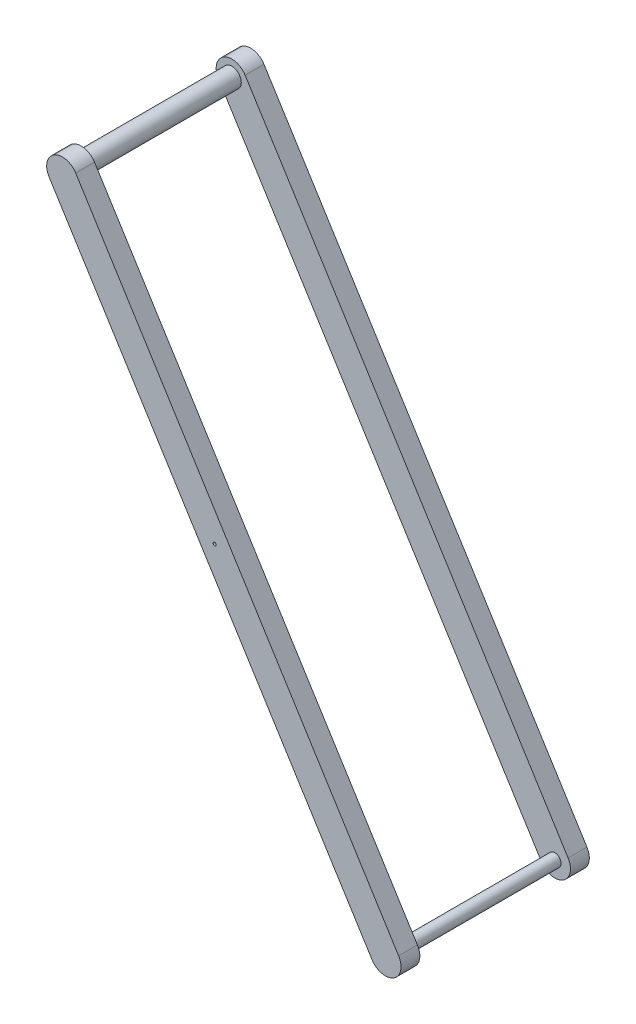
SolidWorks part; units mm, degrees
ref_plane "Front Plane" through (0, 0, 0) normal (0, 0, 1) x (1, 0, 0)
ref_plane "Top Plane" through (0, 0, 0) normal (0, 1, 0) x (1, 0, 0)
ref_plane "Right Plane" through (0, 0, 0) normal (1, 0, 0) x (0, 0, -1)
body saved out of another part "Stock-Ironing Board 2-1"
sketch "Sketch1" plane through (0, 0, 0) normal (0, 0, 1) x (1, 0, 0)
  point P0 (-145.5302, -17.7182)
